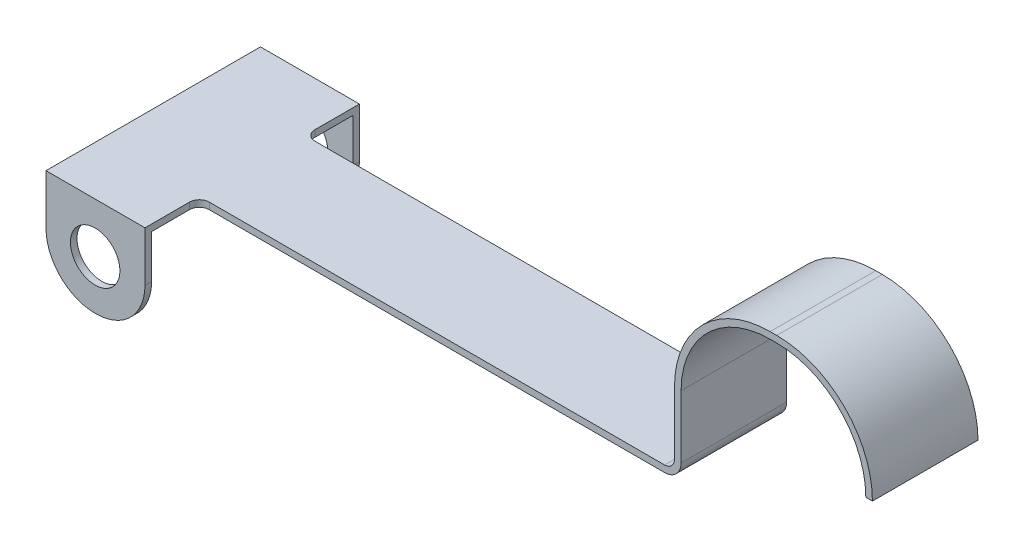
SolidWorks part; units mm, degrees
ref_plane "Plan de face" through (0, 0, 0) normal (0, 0, 1) x (1, 0, 0)
ref_plane "Plan de dessus" through (0, 0, 0) normal (0, 1, 0) x (1, 0, 0)
ref_plane "Plan de droite" through (0, 0, 0) normal (1, 0, 0) x (0, 0, -1)
sketch "Esquisse1" plane through (0, 0, 0) normal (0, 0, 1) x (1, 0, 0)
  line L0 (-32.0603, 7.6433) -> (-18.2603, 7.6433)
  line L4 (-35.3603, 7.8433) -> (-32.3603, 7.8433)
  line L5 (-35.3603, 7.8433) -> (-35.3603, 6.3333)
  line L6 (-33.8703, 4.8433) -> (-33.8503, 4.8433)
  line L7 (-32.3603, 7.3433) -> (-32.3603, 6.3333)
  line L8 (-32.3603, 7.8433) -> (-18.2603, 7.8433)
  line L9 (-17.7603, 8.1433) -> (-17.7603, 10.0433)
  line L10 (-15.0603, 12.7433) -> (-14.8603, 12.7433)
  line L11 (-12.1603, 10.0433) -> (-11.9603, 10.0433)
  line L12 (-32.3603, 7.8433) -> (-17.9603, 7.8433) construction
  line L13 (-17.9603, 8.1433) -> (-17.9603, 10.0433)
  line L14 (-15.0603, 12.9433) -> (-14.8603, 12.9433)
  line L15 (-17.9603, 7.8433) -> (-17.9603, 10.0433) construction
  line L16 (-32.3603, 7.6433) -> (-17.7603, 7.6433) construction
  line L17 (-17.7603, 7.6433) -> (-17.7603, 10.0433) construction
  arc A2 (-35.3603, 6.3333) -> (-33.8703, 4.8433) centre (-33.8703, 6.3333) ccw
  arc A3 (-33.8503, 4.8433) -> (-32.3603, 6.3333) centre (-33.8503, 6.3333) ccw
  circle A4 centre (-33.8703, 6.3333) radius 0.75
  arc A5 (-17.9603, 10.0433) -> (-15.0603, 12.9433) centre (-15.0603, 10.0433) cw
  arc A6 (-14.8603, 12.9433) -> (-11.9603, 10.0433) centre (-14.8603, 10.0433) cw
  arc A7 (-17.7603, 10.0433) -> (-15.0603, 12.7433) centre (-15.0603, 10.0433) cw
  arc A8 (-14.8603, 12.7433) -> (-12.1603, 10.0433) centre (-14.8603, 10.0433) cw
  arc A9 (-18.2603, 7.8433) -> (-17.9603, 8.1433) centre (-18.2603, 8.1433) ccw
  arc A10 (-18.2603, 7.6433) -> (-17.7603, 8.1433) centre (-18.2603, 8.1433) ccw
  arc A11 (-32.0603, 7.6433) -> (-32.3603, 7.3433) centre (-32.0603, 7.3433) ccw
  point P14 (-35.3603, 4.8433)
  point P24 (-17.9603, 12.9433)
  point P27 (-11.9603, 12.9433)
  point P38 (-17.9603, 7.8433)
  dimension "D3" = 1.49
  dimension "D4" = 14.4
  dimension "D5" = 2.9
  dimension "D8" = 0.3
  dimension "D9" = 0.5
  dimension "D10" = 0.3
  dimension "D1" = 3
  dimension "D2" = 3
  dimension "D6" = 6
  dimension "D7" = 0.2
extrude "Extrusion1" add sketch "Esquisse1" along normal blind 6.5
sketch "Esquisse5" plane through (0, 12.9433, 0) normal (0, 1, 0) x (-1, 0, 0)
  line L0 (32.3603, 6.5) -> (32.3603, 0) construction
  line L1 (32.0603, 4.85) -> (9.7494, 4.85)
  line L2 (32.3603, 1.35) -> (32.3603, -1.4614)
  line L3 (32.0603, 1.65) -> (9.7494, 1.65)
  line L4 (9.7494, 4.85) -> (9.7494, 1.65)
  line L6 (32.3603, 8.2669) -> (36.2553, 8.2669)
  line L7 (32.3603, 8.2669) -> (32.3603, 5.15)
  line L8 (32.3603, -1.4614) -> (36.2553, -1.4614)
  line L9 (36.2553, 8.2669) -> (36.2553, -1.4614)
  arc A0 (32.3603, 1.35) -> (32.0603, 1.65) centre (32.0603, 1.35) ccw
  arc A1 (32.0603, 4.85) -> (32.3603, 5.15) centre (32.0603, 5.15) ccw
  point P15 (32.3603, 4.85)
  dimension "D3" = 0.3
  dimension "D1" = 3.2
  dimension "D2" = 1.65
extrude "Enlèv. mat.-Extru.3" cut sketch "Esquisse5" against normal through all flip side to cut
sketch "Esquisse6" plane through (-35.3603, 0, 0) normal (-1, 0, 0) x (0, 0, 1)
  line L1 (0.2, 7.6433) -> (6.3, 7.6433)
  line L2 (0.2, 7.6433) -> (0.2, 3.3401)
  line L3 (0.2, 3.3401) -> (6.3, 3.3401)
  line L4 (6.3, 7.6433) -> (6.3, 3.3401)
  dimension "D1" = 6.1
extrude "Enlèv. mat.-Extru.4" cut sketch "Esquisse6" against normal through all
